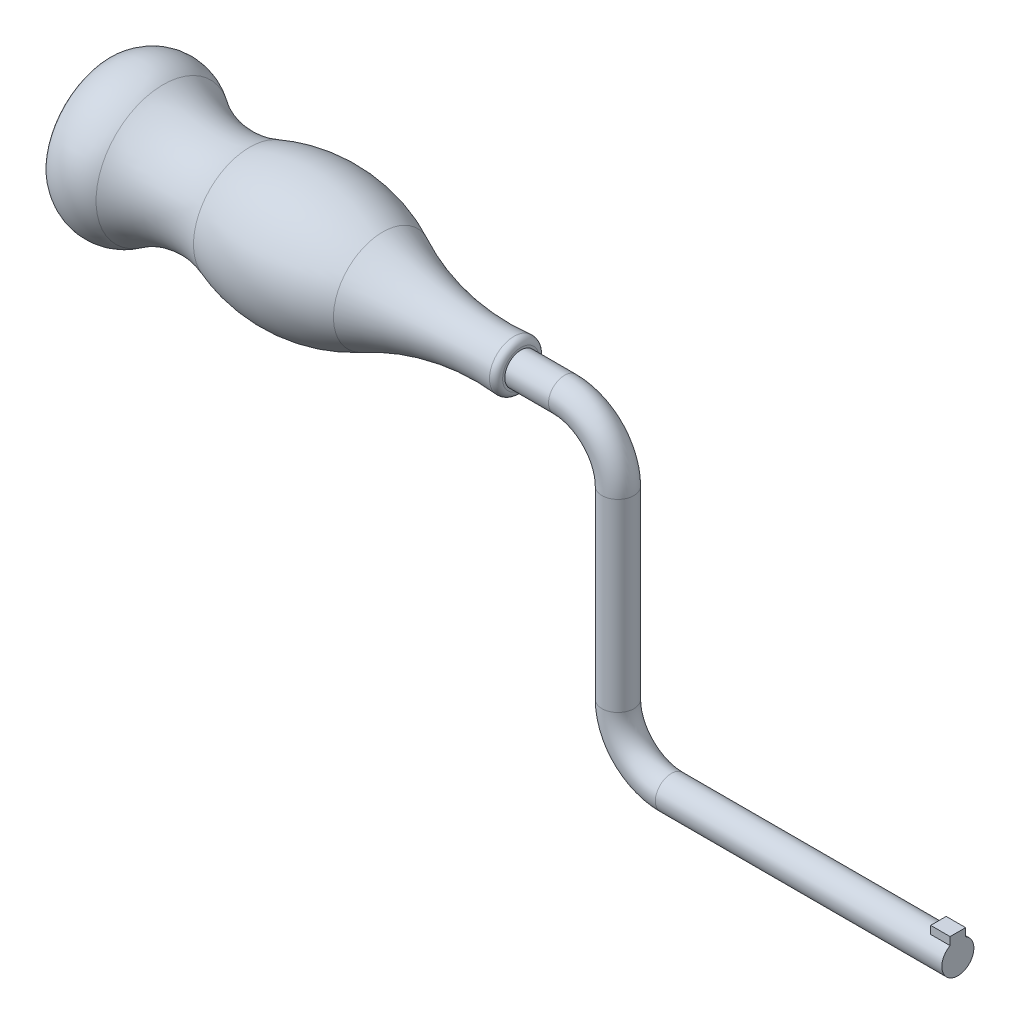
SolidWorks part; units mm, degrees
ref_plane "Front Plane" through (0, 0, 0) normal (0, 0, 1) x (1, 0, 0)
ref_plane "Top Plane" through (0, 0, 0) normal (0, 1, 0) x (1, 0, 0)
ref_plane "Right Plane" through (0, 0, 0) normal (1, 0, 0) x (0, 0, -1)
sketch "Sketch1" plane through (0, 0, 0) normal (0, 0, 1) x (1, 0, 0)
  line L0 (13.335, 313.4356) -> (-24.13, 313.4356)
  line L1 (-11.7107, 313.4356) -> (-5.2578, 313.4356) construction
  line L2 (-31.115, 320.4206) -> (-31.115, 344.5506)
  line L3 (-38.1, 351.5356) -> (-43.815, 351.5356)
  arc A0 (-24.13, 313.4356) -> (-31.115, 320.4206) centre (-24.13, 320.4206) cw
  arc A1 (-31.115, 344.5506) -> (-38.1, 351.5356) centre (-38.1, 344.5506) ccw
  point P8 (-31.115, 313.4356)
  point P12 (-31.115, 351.5356)
  dimension "D3" = 6.985
  dimension "D1" = 44.45
  dimension "D2" = 38.1
  dimension "D4" = 13.335
  dimension "D5" = 12.7
ref_plane "Plane1" through (-43.815, 351.5356, 0) normal (-1, 0, 0) x (0, 0, 1)
sketch "Sketch2" plane through (-43.815, 351.5356, 0) normal (-1, 0, 0) x (0, 0, 1)
  circle A0 centre (0, 0) radius 2.0955
  dimension "D1" = 4.191
sweep "Sweep1" add profiles "Sketch2" path "Sketch1"
sketch "Sketch4" plane through (0, 0, 0) normal (0, 0, 1) x (1, 0, 0)
  line L0 (13.335, 315.5311) -> (13.335, 316.2931)
  line L1 (13.335, 316.2931) -> (10.795, 316.2931)
  line L2 (10.795, 316.2931) -> (10.795, 315.5311)
  line L3 (13.335, 315.5311) -> (-24.13, 315.5311) construction
  line L5 (10.795, 315.5311) -> (10.795, 315.1501)
  line L6 (10.795, 315.1501) -> (13.335, 315.1501)
  line L7 (13.335, 315.1501) -> (13.335, 315.5311)
  dimension "D1" = 1.143
  dimension "D2" = 2.54
extrude "Extrude1" add sketch "Sketch4" along normal mid plane 2.032
sketch "Sketch3" plane through (0, 0, 0) normal (0, 0, 1) x (1, 0, 0)
  line L0 (-38.1, 351.5356) -> (-93.811, 351.5356) construction
  line L2 (-43.815, 351.5356) -> (-43.815, 353.9162)
  line L3 (-43.815, 353.6311) -> (-43.815, 349.4401) construction
  line L5 (-43.815, 354.6788) -> (-43.815, 348.3923) construction
  line L6 (-97.6766, 359.4256) -> (-97.6766, 351.5356)
  line L7 (-97.6766, 351.5356) -> (-43.815, 351.5356)
  line L10 (-38.1, 353.6311) -> (-38.1, 349.4401) construction
  arc A0 (-44.7117, 354.7386) -> (-61.8801, 357.9766) centre (-47.5073, 387.05) cw
  arc A1 (-61.8801, 357.9766) -> (-79.2691, 358.886) centre (-71.6297, 338.2548) ccw
  arc A2 (-79.2691, 358.886) -> (-90.5832, 360.3155) centre (-83.5543, 370.4588) cw
  arc A3 (-90.5832, 360.3155) -> (-97.3695, 360.068) centre (-93.811, 355.6575) ccw
  arc A4 (-43.815, 353.9162) -> (-44.7117, 354.7386) centre (-44.6405, 353.9162) ccw
  arc A5 (-97.3695, 360.068) -> (-97.6766, 359.4256) centre (-96.8511, 359.4256) ccw
  point P19 (-43.815, 354.8288)
  dimension "D1" = 3.6923
  dimension "D2" = 24.1224
  dimension "D3" = 11.9246
  dimension "D6" = 35.5144
  dimension "D7" = 32.432
  dimension "D8" = 5.667
  dimension "D11" = 0.8255
  dimension "D4" = 13.2807
  dimension "D5" = 18.9232
  dimension "D9" = 53.8616
  dimension "D10" = 4.1219
revolve "Revolve1" add sketch "Sketch3" angle 360 about L0
sketch "Sketch5" [suppressed] plane through (0, 0, 0) normal (0, 0, 1) x (1, 0, 0)
  line L0 (-38.1, 351.5356) -> (-103.4533, 351.5356) construction
  line L1 (-38.1, 353.6311) -> (-38.1, 349.4401) construction
  line L2 (-94.615, 360.4169) -> (-94.615, 351.5356)
  line L3 (-94.615, 351.5356) -> (-43.815, 351.5356)
  line L4 (-43.815, 351.5356) -> (-43.815, 354.2187)
  line L5 (-43.815, 353.6311) -> (-43.815, 349.4401) construction
  arc A0 (-93.987, 361.2184) -> (-90.5114, 361.9814) centre (-77.2761, 293.3968) cw
  arc A1 (-89.64, 361.5835) -> (-86.7115, 362.05) centre (-88.265, 362.377) ccw
  arc A2 (-84.6144, 362.3057) -> (-81.6596, 362.5566) centre (-83.185, 362.9964) ccw
  arc A3 (-79.5808, 362.657) -> (-76.6157, 362.6922) centre (-78.105, 363.2419) ccw
  arc A4 (-61.901, 360.9682) -> (-59.0243, 360.2486) centre (-60.325, 361.1588) ccw
  arc A5 (-56.8309, 359.6108) -> (-54.0169, 358.6755) centre (-55.245, 359.6815) ccw
  arc A6 (-51.7516, 357.8235) -> (-49.0188, 356.6725) centre (-50.165, 357.7708) ccw
  arc A7 (-86.0069, 362.699) -> (-85.4543, 362.7664) centre (-77.2761, 293.3968) cw
  arc A8 (-80.9094, 363.1523) -> (-80.385, 363.1776) centre (-77.2761, 293.3968) cw
  arc A9 (-75.8241, 363.2317) -> (-62.5465, 361.6761) centre (-77.2761, 293.3968) cw
  arc A10 (-58.1216, 360.5692) -> (-57.421, 360.3654) centre (-77.2761, 293.3968) cw
  arc A11 (-53.0925, 358.9268) -> (-52.2813, 358.6217) centre (-77.2761, 293.3968) cw
  arc A12 (-48.0776, 356.8513) -> (-44.2502, 354.9461) centre (-77.2761, 293.3968) cw
  arc A13 (-89.64, 361.5835) -> (-90.5114, 361.9814) centre (-90.3549, 361.1709) ccw
  arc A14 (-86.7115, 362.05) -> (-86.0069, 362.699) centre (-85.9037, 361.88) cw
  arc A15 (-84.6144, 362.3057) -> (-85.4543, 362.7664) centre (-85.3576, 361.9466) ccw
  arc A16 (-81.6596, 362.5566) -> (-80.9094, 363.1523) centre (-80.8665, 362.3279) cw
  arc A17 (-79.5808, 362.657) -> (-80.385, 363.1776) centre (-80.3483, 362.3529) ccw
  arc A18 (-76.6157, 362.6922) -> (-75.8241, 363.2317) centre (-75.8413, 362.4064) cw
  arc A19 (-61.901, 360.9682) -> (-62.5465, 361.6761) centre (-62.7206, 360.8692) ccw
  arc A20 (-59.0243, 360.2486) -> (-58.1216, 360.5692) centre (-58.348, 359.7753) cw
  arc A21 (-56.8309, 359.6108) -> (-57.421, 360.3654) centre (-57.6556, 359.574) ccw
  arc A22 (-54.0169, 358.6755) -> (-53.0925, 358.9268) centre (-53.3783, 358.1523) cw
  arc A23 (-51.7516, 357.8235) -> (-52.2813, 358.6217) centre (-52.5767, 357.8508) ccw
  arc A24 (-49.0188, 356.6725) -> (-48.0776, 356.8513) centre (-48.4227, 356.1014) cw
  arc A25 (-93.987, 361.2184) -> (-94.615, 360.4169) centre (-93.7895, 360.4169) ccw
  arc A26 (-44.2502, 354.9461) -> (-43.815, 354.2187) centre (-44.6405, 354.2187) cw
  point P34 (-86.6945, 362.6089)
  point P39 (-81.6018, 363.1127)
  point P44 (-76.5175, 363.2427)
  point P49 (-58.7894, 360.756)
  point P54 (-53.7443, 359.1637)
  point P59 (-48.7091, 357.1381)
  point P62 (-94.615, 361.0606)
  point P65 (-43.815, 354.7106)
  dimension "D10" = 69.85
  dimension "D11" = 1.5875
  dimension "D12" = 0.8255
  dimension "D1" = 5.08
  dimension "D2" = 5.08
  dimension "D3" = 5.08
  dimension "D4" = 5.08
  dimension "D5" = 6.35
  dimension "D6" = 6.35
  dimension "D7" = 3.175
  dimension "D8" = 9.525
  dimension "D9" = 50.8
revolve "Revolve2" [suppressed] add sketch "Sketch5" angle 360 about L0
